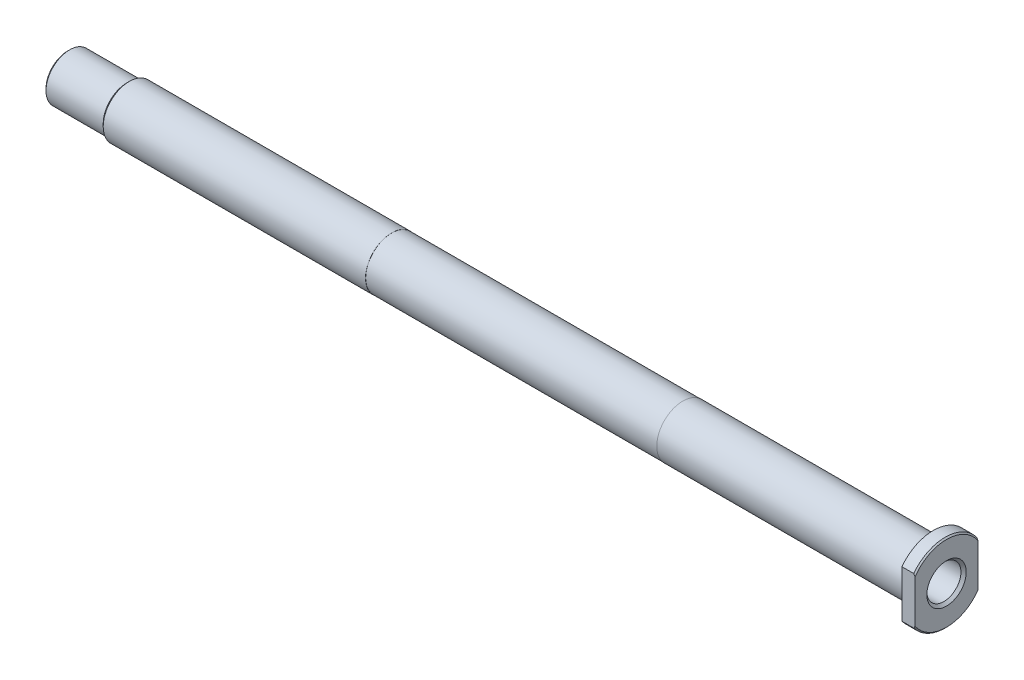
SolidWorks part; units mm, degrees
ref_plane "Plan1" through (0, 0, 0) normal (0, 0, 1) x (1, 0, 0)
ref_plane "Plan2" through (0, 0, 0) normal (0, 1, 0) x (1, 0, 0)
ref_plane "Plan3" through (0, 0, 0) normal (1, 0, 0) x (0, 0, -1)
imported_body "Importée1"
sketch "Esquisse1" plane through (0, 0, 0) normal (0, 0, 1) x (1, 0, 0)
  line L0 (-14.6625, 0) -> (0, 0) construction
  line L1 (0, 15) -> (0, 9) construction
  line L2 (-0.3, 9.95) -> (0, 9.95)
  line L3 (-0.3, 9.95) -> (-0.3, 15)
  line L4 (-0.3, 15) -> (0, 15)
  line L5 (0, 9.95) -> (0, 15)
  line L6 (4.5, 15) -> (0, 15) construction
revolve "Enlèvement de matière-Révolution1" cut sketch "Esquisse1" angle 360 about L0
